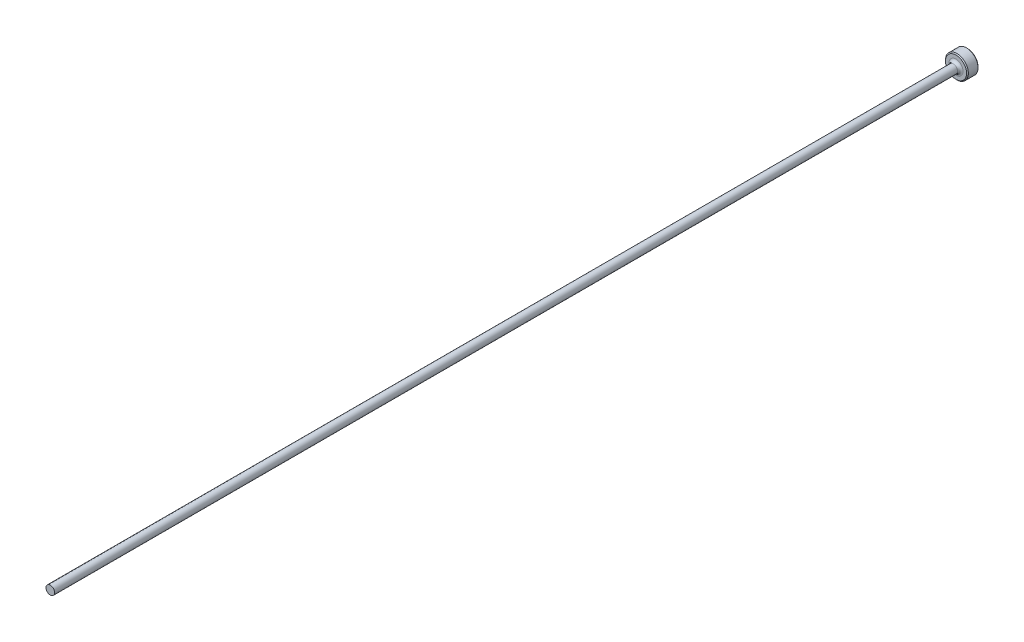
SolidWorks part; units mm, degrees
ref_plane "Front Plane" through (0, 0, 0) normal (0, 0, 1) x (1, 0, 0)
ref_plane "Top Plane" through (0, 0, 0) normal (0, 1, 0) x (1, 0, 0)
ref_plane "Right Plane" through (0, 0, 0) normal (1, 0, 0) x (0, 0, -1)
sketch "Sketch1" plane through (0, 0, 0) normal (1, 0, 0) x (0, 0, -1)
  line L0 (0, 0) -> (0, 3.175)
  line L1 (0, 3.175) -> (-3.175, 3.175)
  line L2 (-3.175, 3.175) -> (-3.175, 1.952)
  line L3 (-3.937, 1.19) -> (-254, 1.19)
  line L4 (-254, 1.19) -> (-254, 0)
  line L5 (-254, 0) -> (0, 0)
  line L6 (25.4347, 0) -> (-130.6739, 0) construction
  arc A0 (-3.175, 1.952) -> (-3.937, 1.19) centre (-3.937, 1.952) cw
  dimension "D4" = 0.762
  dimension "D1" = 2.38
  dimension "D2" = 6.35
  dimension "D3" = 3.175
  dimension "D5" = 254
revolve "Revolve1" add sketch "Sketch1" angle 360 about L6
chamfer "Chamfer1" distance 0.254 angle 45 2 edges at (-3.175, 0, 0) (-3.175, 0, 3.175)
